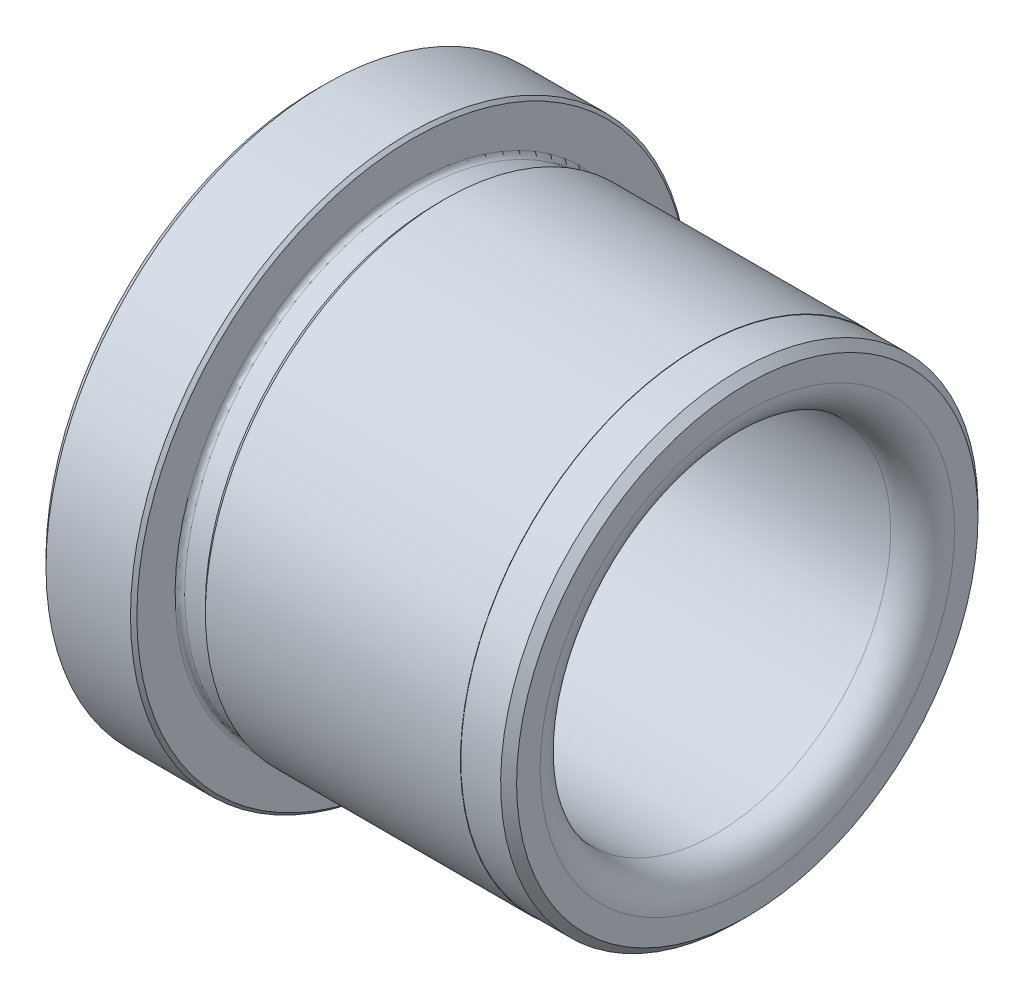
SolidWorks part; units mm, degrees
ref_plane "Front Plane" through (0, 0, 0) normal (0, 0, 1) x (1, 0, 0)
ref_plane "Top Plane" through (0, 0, 0) normal (0, 1, 0) x (1, 0, 0)
ref_plane "Right Plane" through (0, 0, 0) normal (1, 0, 0) x (0, 0, -1)
sketch "Sketch1" plane through (0, 0, 0) normal (0, 0, 1) x (1, 0, 0)
  line L0 (13.5, 14.975) -> (10.5, 14.975)
  line L1 (10.5, 15) -> (-5.5, 15)
  line L2 (10.5, 14.975) -> (10.5, 15)
  line L6 (-7.5, 17.5) -> (-7.5, 14.9)
  line L7 (-7.5, 17.5) -> (-13.5, 17.5)
  line L8 (-13.5, 17.5) -> (-13.5, 0)
  line L13 (13.5, 14.975) -> (13.5, 0)
  line L14 (13.5, 0) -> (-13.5, 0) construction
  line L15 (13.5, 0) -> (-13.5, 0)
  line L16 (-5.5, 15) -> (-5.9, 14.6)
  line L17 (-5.9, 14.6) -> (-7.2, 14.6)
  arc A0 (-7.2, 14.6) -> (-7.5, 14.9) centre (-7.2, 14.9) cw
  point P16 (0, 0)
  dimension "D5" = 0.025
  dimension "D1" = 0.3
  dimension "D2" = 135
  dimension "OD" = 30
  dimension "D3" = 0.4
  dimension "T" = 6
  dimension "HeadDia" = 35
  dimension "S" = 27
  dimension "HeadGap" = 2
  dimension "LeadLength" = 3
revolve "Revolve1" add sketch "Sketch1" angle 360 about L14
sketch "Sketch2" plane through (13.5, 0, 0) normal (1, 0, 0) x (0, 0, -1)
  circle A0 centre (0, 0) radius 11
  circle A1 centre (0, 0) radius 15 construction
  dimension "ID" = 22
extrude "Extrude1" cut sketch "Sketch2" against normal blind 76
sketch "Sketch4" [suppressed] plane through (7, 0, 0) normal (1, 0, 0) x (0, 0, -1)
  circle A0 centre (0, 0) radius 21.01
  circle A2 centre (0, 0) radius 21 construction
  dimension "D1" = 0.01
extrude "Extrude3" [suppressed] cut sketch "Sketch4" against normal through all
fillet "Fillet2" radius 2 1 edges at (13.5, 11, 0)
chamfer "Chamfer3" distance 0.5 angle 45 3 edges at (13.5, 14.975, 0) (-13.5, -11, 0) (-13.5, 17.5, 0)
chamfer "Chamfer4" distance 0.2 angle 45 1 edges at (-7.5, 17.5, 0)
